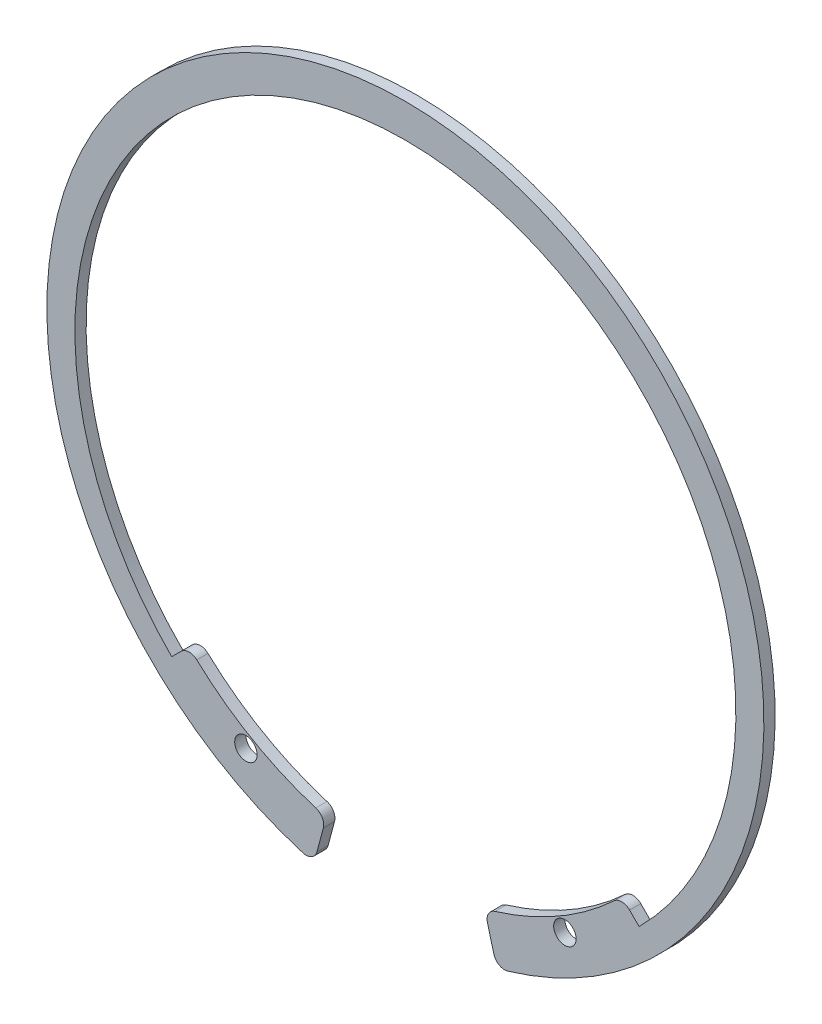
SolidWorks part; units mm, degrees
ref_plane "Plan1" through (0, 0, 0) normal (0, 0, 1) x (1, 0, 0)
ref_plane "Plan2" through (0, 0, 0) normal (0, 1, 0) x (1, 0, 0)
ref_plane "Plan3" through (0, 0, 0) normal (1, 0, 0) x (0, 0, -1)
sketch "Esquisse1" plane through (0, 0, 0) normal (0, 0, 1) x (1, 0, 0)
  line L0 (-7.6352, 28.4948) -> (2.0576, -7.6791) construction
  line L1 (0, 0) -> (0, -67.082) construction
  line L2 (7.8952, -29.4654) -> (7.3243, -27.3348)
  line L3 (0, 0) -> (7, -7) construction
  line L4 (20.0105, -20.0105) -> (20.8597, -20.8597)
  line L5 (-7.8952, -29.4654) -> (-7.3243, -27.3348)
  line L6 (-20.0105, -20.0105) -> (-20.8597, -20.8597)
  line L7 (0, 0) -> (0, 29.5) construction
  line L8 (0, 29.5) -> (0, 32.5) construction
  line L9 (-7.6098, -28.4001) -> (-20.8597, -20.8597) construction
  arc A0 (20.8597, -20.8597) -> (-20.8597, -20.8597) centre (0, 0) ccw
  arc A1 (-18.6217, -19.986) -> (-7.9975, -26.1198) centre (0, 0) ccw
  arc A2 (9.147, -30.1648) -> (-9.147, -30.1648) centre (0, 0.5) ccw
  arc A4 (7.9975, -26.1198) -> (18.6217, -19.986) centre (0, 0) ccw
  arc A5 (18.6217, -19.986) -> (20.0105, -20.0105) centre (19.3034, -20.7176) cw
  arc A6 (7.3243, -27.3348) -> (7.9975, -26.1198) centre (8.2903, -27.076) cw
  arc A7 (-7.3243, -27.3348) -> (-7.9975, -26.1198) centre (-8.2903, -27.076) ccw
  arc A8 (-20.0105, -20.0105) -> (-18.6217, -19.986) centre (-19.3034, -20.7176) cw
  arc A9 (-9.147, -30.1648) -> (-7.8952, -29.4654) centre (-8.8612, -29.2066) ccw
  arc A10 (9.147, -30.1648) -> (7.8952, -29.4654) centre (8.8612, -29.2066) cw
  circle A11 centre (-14.2347, -24.6299) radius 1
  circle A12 centre (14.2347, -24.6299) radius 1
  point P19 (19.3159, -19.3159)
  point P22 (7.0701, -26.386)
  point P25 (-7.0701, -26.386)
  point P30 (-19.3159, -19.3159)
  point P33 (-8.1571, -30.4429)
  point P36 (8.1571, -30.4429)
  dimension "D1" = 32
  dimension "D2" = 4.2
  dimension "D3" = 3
  dimension "D6" = 1
  dimension "D4" = 0.5
  dimension "D7" = 2
  dimension "a" = 15
  dimension "D5" = 30
extrude "Base-Extrusion" add sketch "Esquisse1" along normal blind 1
equation "\"D5@Esquisse1\"=\"a@Esquisse1\"*2"
equation "\"D6@Esquisse1\"=\"D7@Esquisse1\"/2"
equation "\"D4@Esquisse1\" = \"D6@Esquisse1\"/2"
